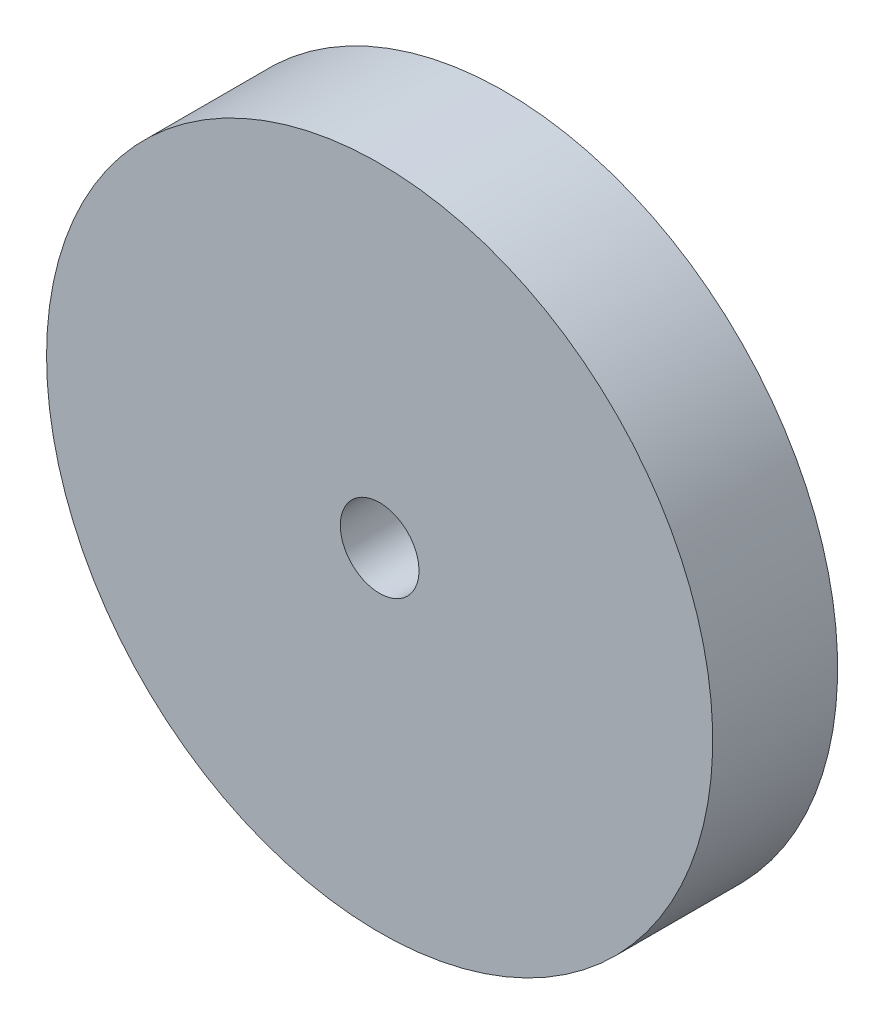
SolidWorks part; units mm, degrees
ref_plane "Front Plane" through (0, 0, 0) normal (0, 0, 1) x (1, 0, 0)
ref_plane "Top Plane" through (0, 0, 0) normal (0, 1, 0) x (1, 0, 0)
ref_plane "Right Plane" through (0, 0, 0) normal (1, 0, 0) x (0, 0, -1)
sketch "Sketch1" plane through (0, 0, 0) normal (0, 0, 1) x (1, 0, 0)
  circle A0 centre (0, 0) radius 25.4
  circle A1 centre (0, 0) radius 3
  dimension "D1" = 50.8
  dimension "D2" = 6
extrude "Boss-Extrude1" add sketch "Sketch1" along normal blind 9.525
